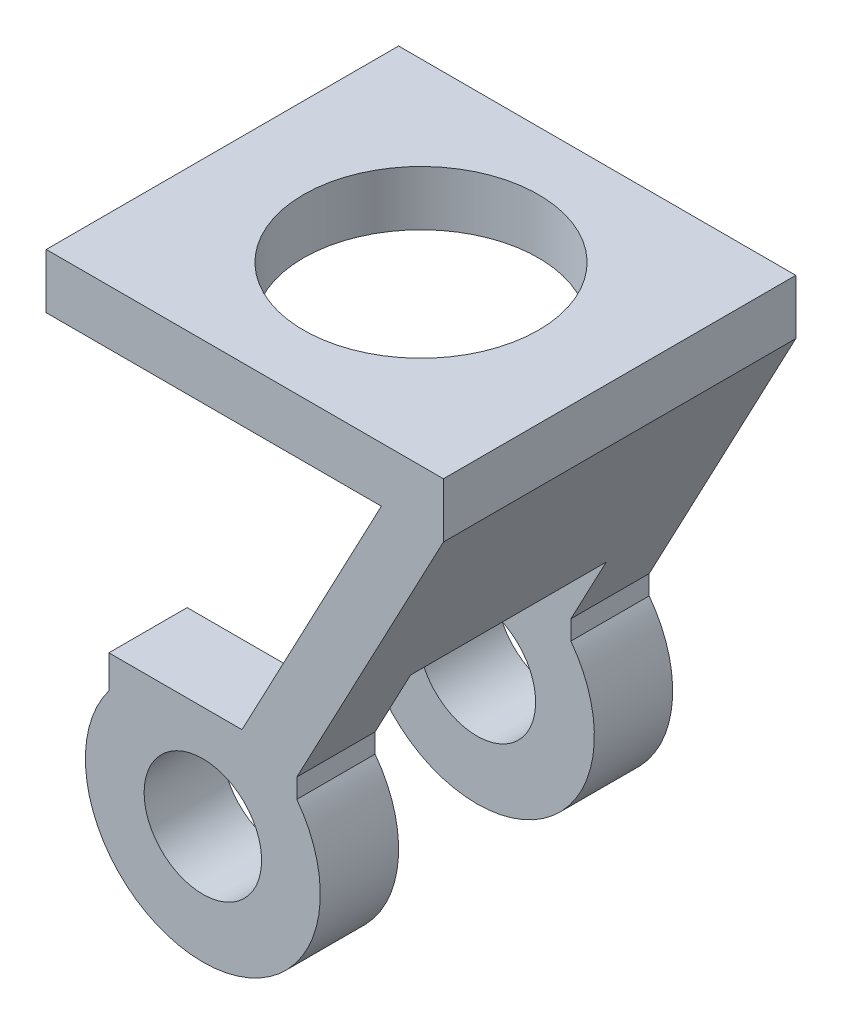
SolidWorks part; units mm, degrees
ref_plane "Front Plane" through (0, 0, 0) normal (0, 0, 1) x (1, 0, 0)
ref_plane "Top Plane" through (0, 0, 0) normal (0, 1, 0) x (1, 0, 0)
ref_plane "Right Plane" through (0, 0, 0) normal (1, 0, 0) x (0, 0, -1)
sketch "Sketch1" plane through (0, 0, 0) normal (0, 0, 1) x (1, 0, 0)
  line L0 (0, 0) -> (0, 46.2614) construction
  line L1 (-17.5906, 9) -> (23.7254, 9) construction
  line L2 (12, 9) -> (12, 11.4694)
  line L3 (12, 11.4694) -> (30.7213, 46.8178)
  line L4 (-12, 13.2086) -> (-12, 9)
  line L5 (30.7213, 46.8178) -> (30.7213, 53.8178)
  line L6 (5, 13.2086) -> (22.8002, 46.8178)
  line L7 (30.7213, 53.8178) -> (-20, 53.8178)
  line L8 (-20, 53.8178) -> (-20, 46.8178)
  line L9 (5, 9) -> (5, 13.2086) construction
  line L10 (-20, 46.8178) -> (22.8002, 46.8178)
  line L12 (5, 13.2086) -> (-12, 13.2086)
  line L13 (5, 13.2086) -> (24.5353, 50.0941) construction
  arc A0 (-12, 9) -> (12, 9) centre (0, 0) ccw
  circle A1 centre (0, 0) radius 7.5
  dimension "D1" = 15
  dimension "D2" = 30
  dimension "D3" = 9
  dimension "D5" = 7
  dimension "D6" = 7
  dimension "D7" = 40
  dimension "D8" = 20
  dimension "D4" = 7
extrude "Boss-Extrude1" add sketch "Sketch1" along normal blind 45
sketch "Sketch2" plane through (30.7213, 0, 0) normal (1, 0, 0) x (0, 0, -1)
  line L0 (-45, 53.8178) -> (-45, -15) construction
  line L1 (-45, -15) -> (0, -15) construction
  line L3 (0, -15) -> (0, 9) construction
  line L4 (0, -15) -> (0, 53.8178) construction
  line L5 (0, 53.8178) -> (-45, 53.8178) construction
  line L6 (-35, 20.0111) -> (-35, -15)
  line L7 (-10, -15) -> (-10, 20.0111)
  line L11 (-35, 53.8178) -> (-35, -15) construction
  line L12 (-10, -15) -> (-10, 53.8178) construction
  line L13 (-35, -15) -> (-10, -15)
  line L14 (-10, 20.0111) -> (-35, 20.0111)
  dimension "D1" = 10
  dimension "D2" = 10
extrude "Cut-Extrude1" cut sketch "Sketch2" against normal blind 61
sketch "Sketch3" plane through (0, 53.8178, 0) normal (0, 1, 0) x (1, 0, 0)
  line L0 (-20, 0) -> (30.7213, -45) construction
  line L1 (30.7213, 0) -> (-20, -45) construction
  line L2 (30.7213, -45) -> (-20, -45) construction
  circle A0 centre (5.3606, -22.5) radius 15
  dimension "D1" = 30
extrude "Cut-Extrude2" cut sketch "Sketch3" against normal up to surface (7 mm away)
